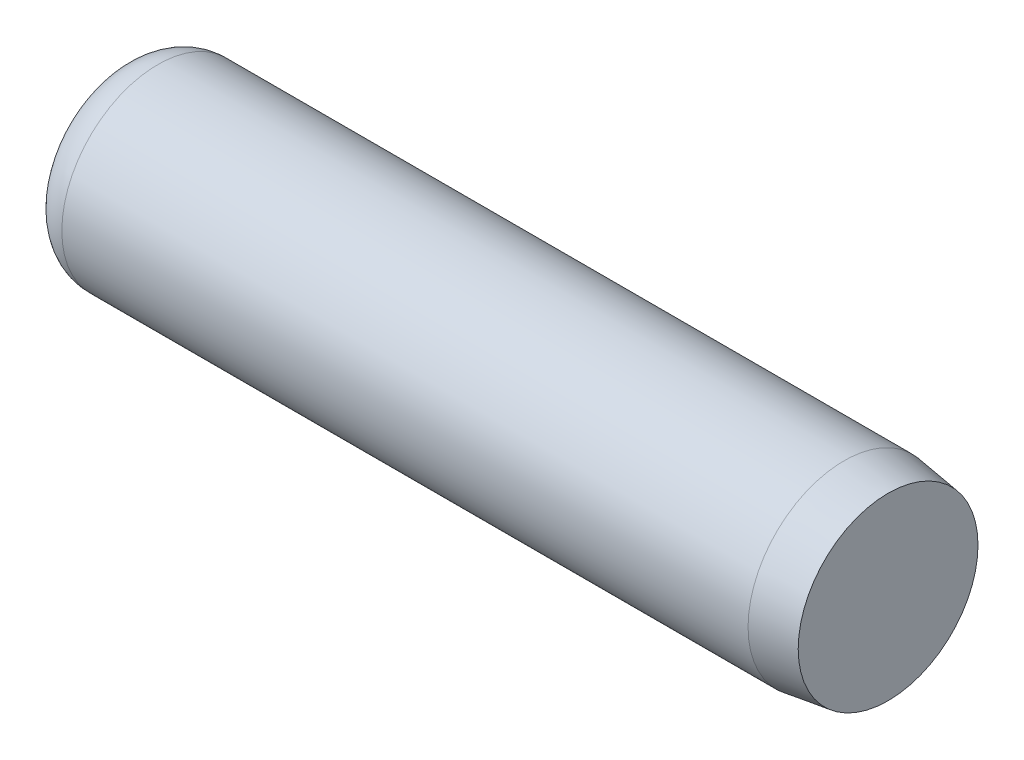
SolidWorks part; units mm, degrees
ref_plane "Plane1" through (0, 0, 0) normal (0, 0, 1) x (1, 0, 0)
ref_plane "Plane2" through (0, 0, 0) normal (0, 1, 0) x (1, 0, 0)
ref_plane "Plane3" through (0, 0, 0) normal (1, 0, 0) x (0, 0, -1)
other "Configuration Table"
sketch "Sketch1" plane through (0, 0, 0) normal (0, 0, 1) x (1, 0, 0)
  line L1 (-6.35, 0) -> (128.8927, 0) construction
  line L2 (0, 0) -> (101.6, 0)
  line L3 (101.6, 0) -> (101.6, 11.8833)
  line L4 (101.6, 11.8833) -> (95.7888, 12.7)
  line L5 (95.7888, 12.7) -> (5.08, 12.7)
  line L6 (0, 7.62) -> (0, 0)
  arc A0 (5.08, 12.7) -> (0, 7.62) centre (5.08, 7.62) ccw
  dimension "fillet" = 5.08
  dimension "D3" = 8
  dimension "Diameter" = 25.4
  dimension "Length" = 101.6
  dimension "diameter_B" = 23.7666
revolve "Base-Revolve" add sketch "Sketch1" angle 360 about L1
